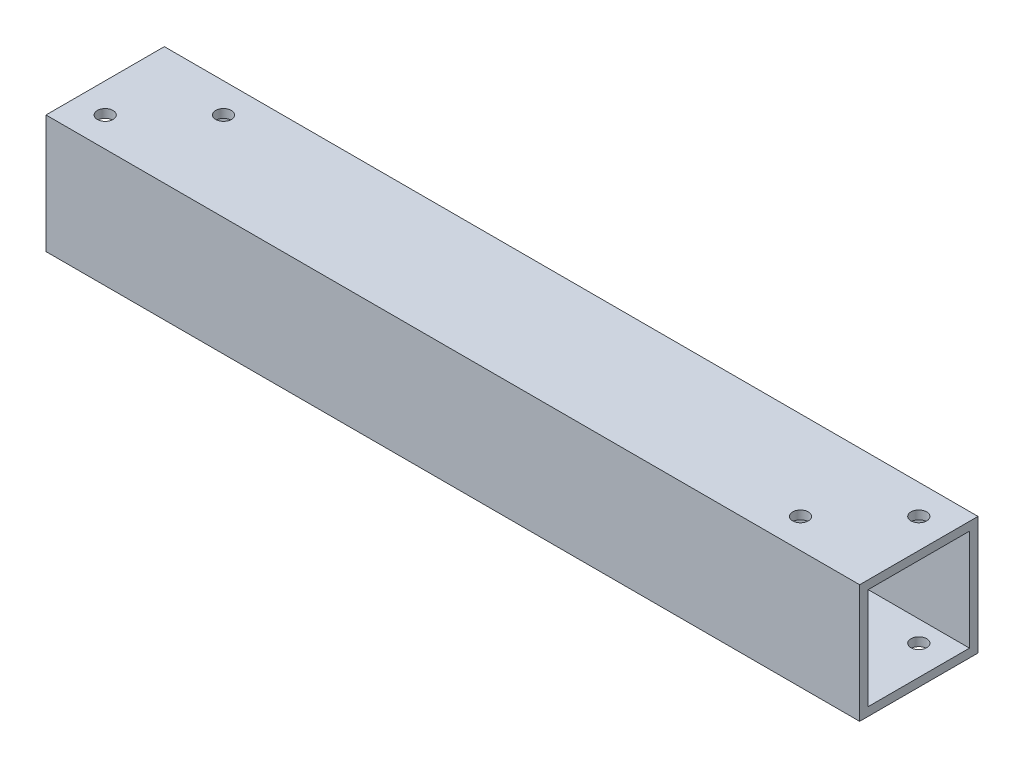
SolidWorks part; units mm, degrees
ref_plane "Front" through (0, 0, 0) normal (0, 0, 1) x (1, 0, 0)
ref_plane "Top" through (0, 0, 0) normal (0, 1, 0) x (1, 0, 0)
ref_plane "Right" through (0, 0, 0) normal (1, 0, 0) x (0, 0, -1)
sketch "Sketch1" plane through (0, 0, 0) normal (1, 0, 0) x (0, 0, -1)
  line L1 (0, 0) -> (50.8, 0)
  line L2 (0, 0) -> (0, 50.8)
  line L3 (0, 50.8) -> (50.8, 50.8)
  line L4 (50.8, 0) -> (50.8, 50.8)
  line L5 (3.6576, 47.1424) -> (47.1424, 47.1424)
  line L6 (3.6576, 47.1424) -> (3.6576, 3.6576)
  line L7 (3.6576, 3.6576) -> (47.1424, 3.6576)
  line L8 (47.1424, 47.1424) -> (47.1424, 3.6576)
  dimension "D1" = 50.8
  dimension "D2" = 50.8
  dimension "D3" = 3.6576
  dimension "D4" = 3.6576
  dimension "D5" = 3.6576
  dimension "D6" = 3.6576
extrude "Extrude1" add sketch "Sketch1" along normal blind 349.25
sketch "Sketch3" plane through (0, 50.8, 0) normal (0, 1, 0) x (1, 0, 0)
  line L0 (0, 50.8) -> (0, 0) construction
  line L1 (0, 25.4) -> (349.25, 25.4) construction
  line L2 (349.25, 50.8) -> (349.25, 0) construction
  circle A0 centre (12.7, 12.7) radius 3.3731
  circle A1 centre (38.1, 38.1) radius 3.3731
  circle A2 centre (336.55, 38.1) radius 3.3731
  circle A3 centre (311.15, 12.7) radius 3.3731
  dimension "D1" = 6.7462
  dimension "D7" = 25.4
  dimension "D8" = 12.7
  dimension "D9" = 12.7
  dimension "D2" = 12.7
  dimension "D3" = 38.1
  dimension "D4" = 12.7
  dimension "D5" = 25.4
  dimension "D6" = 12.7
extrude "Cut-Extrude1" cut sketch "Sketch3" against normal through all
